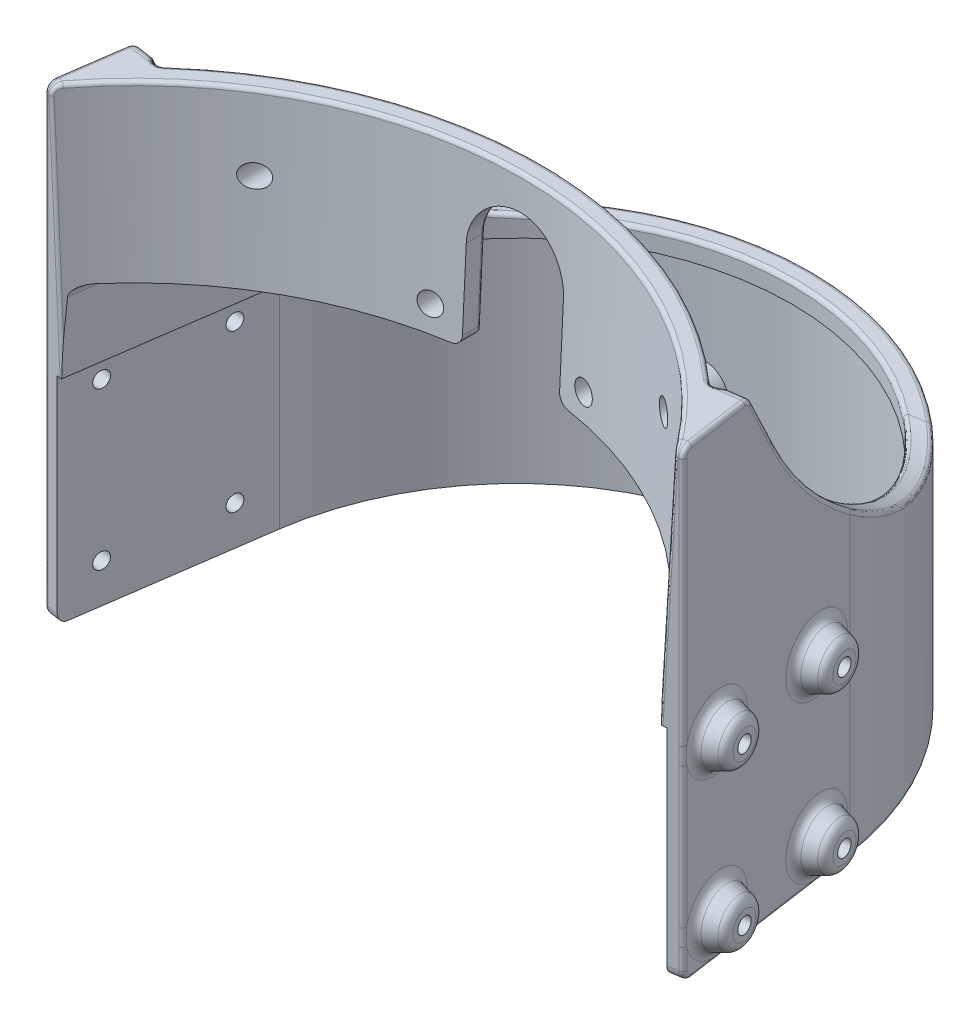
SolidWorks part; units mm, degrees
ref_plane "Front Plane" through (0, 0, 0) normal (0, 0, 1) x (1, 0, 0)
ref_plane "Top Plane" through (0, 0, 0) normal (0, 1, 0) x (1, 0, 0)
ref_plane "Right Plane" through (0, 0, 0) normal (1, 0, 0) x (0, 0, -1)
sketch "Sketch1" plane through (0, 0, 0) normal (0, 1, 0) x (1, 0, 0)
  line L0 (-94.2861, -143.8372) -> (-103.2971, -206.6946)
  line L1 (-103.2971, -206.6946) -> (-98.5828, -207.3704)
  line L2 (-98.5828, -207.3704) -> (-89.5718, -144.513)
  line L3 (0, -157.3537) -> (0, 60.4833) construction
  line L4 (103.2971, -206.6946) -> (98.5828, -207.3704)
  line L5 (98.5828, -207.3704) -> (89.5718, -144.513)
  line L6 (94.2861, -143.8372) -> (103.2971, -206.6946)
  line L8 (0, -157.3537) -> (-94.2861, -143.8372) construction
  line L9 (-89.5718, -144.513) -> (-107.0231, -266.2464) construction
  arc A0 (94.2861, -143.8372) -> (-94.2861, -143.8372) centre (0, -157.3537) ccw
  arc A1 (-89.5718, -144.513) -> (89.5718, -144.513) centre (0, -157.3537) cw
  arc A2 (89.5718, -144.513) -> (-89.5718, -144.513) centre (0, -157.3537) ccw construction
  dimension "D2" = 4.7625
  dimension "D3" = 63.5
extrude "Boss-Extrude1" add sketch "Sketch1" along normal blind 76.2
sketch "Sketch17" plane through (0, 76.2, 0) normal (0, 1, 0) x (1, 0, 0)
  line L10 (-97.0114, -207.5957) -> (-88.0003, -144.7383)
  line L11 (88.0003, -144.7383) -> (97.0114, -207.5957)
  line L12 (-98.5828, -207.3704) -> (-89.5718, -144.513)
  line L13 (89.5718, -144.513) -> (98.5828, -207.3704)
  line L14 (-98.5828, -207.3704) -> (-89.5718, -144.513)
  line L15 (89.5718, -144.513) -> (98.5828, -207.3704)
  line L16 (98.5828, -207.3704) -> (97.0114, -207.5957)
  line L17 (-97.0114, -207.5957) -> (-98.5828, -207.3704)
  arc A4 (88.0003, -144.7383) -> (-88.0003, -144.7383) centre (0, -157.3537) ccw
  arc A5 (89.5718, -144.513) -> (-89.5718, -144.513) centre (0, -157.3537) ccw
  arc A6 (89.5718, -144.513) -> (-89.5718, -144.513) centre (0, -157.3537) ccw
  dimension "D1" = 0
  dimension "D2" = 1.5875
extrude "Boss-Extrude5" add sketch "Sketch17" against normal blind 6.35
hole_wizard "1/4-20 Tapped Hole2" positions "Sketch14" profile "Sketch15" tap size "1/4-20" standard "ANSI Inch"
sketch "Sketch14" plane through (-72.1826, 0, -10.3479) normal (-0.9899, 0, -0.1419) x (-0.1419, 0, 0.9899)
  line L1 (168.4613, 63.5) -> (206.5613, 63.5) construction
  line L2 (168.4613, 63.5) -> (168.4613, 12.7) construction
  line L3 (168.4613, 12.7) -> (206.5613, 12.7) construction
  line L4 (206.5613, 63.5) -> (206.5613, 12.7) construction
  line L5 (168.4613, 63.5) -> (206.5613, 12.7) construction
  line L6 (168.4613, 12.7) -> (206.5613, 63.5) construction
  line L14 (155.7613, 0) -> (219.2613, 0) construction
  line L15 (219.2613, 76.2) -> (219.2613, 0) construction
  point P3 (206.5613, 12.7)
  point P110 (168.4613, 63.5)
  point P111 (168.4613, 12.7)
  point P112 (206.5613, 63.5)
  point P150 (187.5113, 38.1)
  dimension "D1" = 50.8
  dimension "D2" = 38.1
  dimension "D3" = 38.1
  dimension "D4" = 31.75
sketch "Sketch15" plane through (-101.4949, 12.7, 194.1231) normal (0, 1, 0) x (-0.1419, 0, 0.9899)
  line L0 (0, 0) -> (0, 13.6835)
  line L1 (0, 13.6835) -> (2.5527, 13.6835)
  line L2 (2.5527, 13.6835) -> (2.5527, 0)
  line L5 (2.5527, 0) -> (0, 0)
  line L11 (0, -6.35) -> (0, 107.95) construction
  dimension "Thread Major Dia." = 5.1054
  dimension "Thru Tap Drill Depth" = 13.6835
sketch "Sketch31" plane through (-72.1826, 0, -10.3479) normal (-0.9899, 0, -0.1419) x (-0.1419, 0, 0.9899)
  circle A0 centre (168.4613, 63.5) radius 9.525
  circle A1 centre (206.5613, 63.5) radius 9.525
  circle A2 centre (206.5613, 12.7) radius 9.525
  circle A3 centre (168.4613, 12.7) radius 9.525
  dimension "D1" = 19.05
extrude "Boss-Extrude6" add sketch "Sketch31" along normal blind 7.9375
hole_wizard "1/4-20 Tapped Hole3" positions "Sketch32" profile "Sketch33" tap size "1/4-20" standard "ANSI Inch"
sketch "Sketch32" plane through (-80.0398, 0, -11.4743) normal (-0.9899, 0, -0.1419) x (-0.1419, 0, 0.9899)
  point P0 (168.4613, 63.5)
  point P3 (206.5613, 63.5)
  point P6 (206.5613, 12.7)
  point P9 (168.4613, 12.7)
sketch "Sketch33" plane through (-103.9455, 63.5, 155.2823) normal (0, 1, 0) x (-0.1419, 0, 0.9899)
  line L0 (0, 0) -> (0, 206.1523)
  line L1 (0, 206.1523) -> (2.5527, 206.1523)
  line L2 (2.5527, 206.1523) -> (2.5527, 0)
  line L5 (2.5527, 0) -> (0, 0)
  line L11 (0, -6.35) -> (0, 107.95) construction
  dimension "Thread Major Dia." = 5.1054
  dimension "Thru Tap Drill Depth" = 206.1523
sketch "Sketch39" plane through (-72.1826, 0, -10.3479) normal (-0.9899, 0, -0.1419) x (-0.1419, 0, 0.9899)
  line L0 (219.2613, 76.2) -> (219.2613, 149.86)
  line L1 (219.2613, 149.86) -> (193.8613, 149.86)
  line L2 (193.8613, 149.86) -> (155.7613, 76.2)
  line L4 (155.7613, 76.2) -> (219.2613, 76.2)
  line L7 (219.2613, 76.2) -> (219.2613, 0) construction
  dimension "D1" = 73.66
  dimension "D2" = 25.4
extrude "Boss-Extrude7" add sketch "Sketch39" against normal blind 6.35
mirror "Mirror2" about plane through (0, 0, 0) normal (1, 0, 0) of "Boss-Extrude7", "1/4-20 Tapped Hole3", "Boss-Extrude6", "1/4-20 Tapped Hole2"
sketch "Sketch36" plane through (0, 0, 0) normal (1, 0, 0) x (0, 0, -1)
  line L0 (-155.6512, 149.86) -> (-158.3162, 95.25)
  line L1 (-158.3162, 95.25) -> (-155.2174, 158.75) construction
  line L2 (-158.3162, 95.25) -> (-151.9587, 95.25)
  line L3 (-151.9587, 95.25) -> (-149.2937, 149.86)
  line L4 (-280.9474, 99.06) -> (-280.9474, 197.9835) construction
  line L6 (-149.2937, 149.86) -> (-155.6512, 149.86)
  line L10 (-206.6946, 149.86) -> (-181.5516, 149.86) construction
  line L11 (-167.2168, 95.25) -> (-158.3162, 95.25) construction
  dimension "D2" = 6.35
revolve "Revolve1" add sketch "Sketch36" about L4
sketch "Sketch44" plane through (0, 0, 0) normal (1, 0, 0) x (0, 0, -1)
  line L0 (-155.6512, 149.86) -> (-162.9644, 0)
  line L1 (-162.9644, 0) -> (-180.9521, 0)
  line L3 (-180.9521, 0) -> (-180.9521, 149.86)
  line L4 (-180.9521, 149.86) -> (-155.6512, 149.86)
  line L5 (-280.9474, 250.5823) -> (-280.9474, 56.4129) construction
  line L12 (-158.3162, 95.25) -> (-130.6953, 95.25) construction
  line L15 (-207.3704, 0) -> (-144.513, 0) construction
  dimension "D1" = 25.3009
chamfer "Chamfer4" distance 7.9375 angle 20 4 edges at (-110.7037, 12.7, 202.4253) (-105.2971, 12.7, 164.7109) (-110.7037, 63.5, 202.4253) (-105.2971, 63.5, 164.7109)
chamfer "Chamfer5" distance 7.9375 angle 20 4 edges at (110.7037, 12.7, 202.4253) (110.7037, 63.5, 202.4253) (105.2971, 63.5, 164.7109) (105.2971, 12.7, 164.7109)
fillet "Fillet1" radius 101.6 2 edges at (91.1432, 76.2, 144.2877) (-91.1432, 76.2, 144.2877)
sketch "Sketch43" plane through (0, 0, 0) normal (0, 0, 1) x (1, 0, 0)
  line L4 (-15.7201, 95.25) -> (15.7201, 95.25)
  line L6 (-15.7183, 123.7631) -> (-15.7201, 96.0828)
  line L7 (15.7201, 96.0828) -> (15.7183, 123.7631)
  line L8 (-15.7183, 123.7631) -> (-15.7201, 95.25)
  line L9 (15.7201, 95.25) -> (15.7183, 123.7631)
  line L19 (-95.022, 95.25) -> (95.022, 95.25) construction
  spline S3 degree 3 poles (-4842.4899, -1040.5795) (-637.748, -163.601) (32.2701, 43.383) (15.3122, 127.3124) (15.1865, 127.8073) (14.8845, 128.7879) (14.7075, 129.2748) (14.1118, 130.6897) (13.6266, 131.5831) (12.7684, 132.8498) (12.4591, 133.2613) (11.8013, 134.0515) (11.4553, 134.4274) (10.3681, 135.4994) (9.5778, 136.1405) (8.2915, 136.9896) (7.8461, 137.253) (6.941, 137.7306) (6.4789, 137.9463) (5.5358, 138.3324) (5.0548, 138.5028) (4.0737, 138.7975) (3.5709, 138.9224) (2.0526, 139.2211) (1.0352, 139.3198) (-0.4988, 139.321) (-1.0114, 139.2968) (-2.0393, 139.1975) (-2.5517, 139.1226) (-4.0604, 138.8267) (-5.0382, 138.5347) (-6.4628, 137.9536) (-6.933, 137.7346) (-7.8414, 137.2558) (-8.2809, 136.9958) (-9.5568, 136.1557) (-10.3509, 135.5154) (-11.8198, 134.069) (-12.4712, 133.286) (-13.3283, 132.0246) (-13.5939, 131.5895) (-14.0837, 130.6892) (-14.3082, 130.2227) (-14.9043, 128.8082) (-15.2048, 127.8361) (-15.5106, 126.334) (-15.5883, 125.8247) (-27.0509, 12.3972) (1210.903, -180.63) (4930.8683, -566.4945) knots -5.158971 -5.158971 -5.158971 -5.158971 0.0625 0.0625 0.09375 0.09375 0.125 0.125 0.1875 0.1875 0.21875 0.21875 0.25 0.25 0.3125 0.3125 0.34375 0.34375 0.375 0.375 0.40625 0.40625 0.4375 0.4375 0.5 0.5 0.53125 0.53125 0.5625 0.5625 0.625 0.625 0.65625 0.65625 0.6875 0.6875 0.75 0.75 0.8125 0.8125 0.84375 0.84375 0.875 0.875 0.9375 0.9375 0.96875 0.96875 7.83165 7.83165 7.83165 7.83165 only from (15.7183, 123.7631) to (-15.7183, 123.7631)
  spline S4 degree 3 poles (15.7183, 123.7631) (15.7182, 124.7981) (15.6148, 125.8144) (15.3122, 127.3124) (15.1865, 127.8073) (14.8845, 128.7879) (14.7075, 129.2748) (14.1118, 130.6897) (13.6266, 131.5831) (12.7684, 132.8498) (12.4591, 133.2613) (11.8013, 134.0515) (11.4553, 134.4274) (10.3681, 135.4994) (9.5778, 136.1405) (8.2915, 136.9896) (7.8461, 137.253) (6.941, 137.7306) (6.4789, 137.9463) (5.5358, 138.3324) (5.0548, 138.5028) (4.0737, 138.7975) (3.5709, 138.9224) (2.0526, 139.2211) (1.0352, 139.3198) (-0.4988, 139.321) (-1.0114, 139.2968) (-2.0393, 139.1975) (-2.5517, 139.1226) (-4.0604, 138.8267) (-5.0382, 138.5347) (-6.4628, 137.9536) (-6.933, 137.7346) (-7.8414, 137.2558) (-8.2809, 136.9958) (-9.5568, 136.1557) (-10.3509, 135.5154) (-11.8198, 134.069) (-12.4712, 133.286) (-13.3283, 132.0246) (-13.5939, 131.5895) (-14.0837, 130.6892) (-14.3082, 130.2227) (-14.9043, 128.8082) (-15.2048, 127.8361) (-15.5106, 126.334) (-15.5883, 125.8247) (-15.6922, 124.7964) (-15.7182, 124.2806) (-15.7183, 123.7631) knots 0 0 0 0 0.0625 0.0625 0.09375 0.09375 0.125 0.125 0.1875 0.1875 0.21875 0.21875 0.25 0.25 0.3125 0.3125 0.34375 0.34375 0.375 0.375 0.40625 0.40625 0.4375 0.4375 0.5 0.5 0.53125 0.53125 0.5625 0.5625 0.625 0.625 0.65625 0.65625 0.6875 0.6875 0.75 0.75 0.8125 0.8125 0.84375 0.84375 0.875 0.875 0.9375 0.9375 0.96875 0.96875 1 1 1 1
  dimension "D1" = 0
extrude "Cut-Extrude5" cut sketch "Sketch43" along normal blind 190.5
revolve "Cut-Revolve2" cut sketch "Sketch44" angle 360 about L5
fillet "Fillet2" radius 3.175 4 edges at (95.8705, 95.25, 199.6372) (-95.8705, 95.25, 199.6372)
fillet "Fillet4" radius 0.635 6 edges at (54.7442, 95.25, 164.152) (89.2308, 95.25, 187.5492) (-54.7442, 95.25, 164.152) (-89.9013, 95.25, 187.7612) (92.4885, 94.8193, 187.1684) (-92.4885, 94.8193, 187.1684)
fillet "Fillet3" radius 3.175 8 edges at (-102.2234, 149.86, 206.8485) (102.2234, 149.86, 206.8485) (95.9795, 149.86, 182.0839) (-95.9795, 149.86, 182.0839) (-15.7201, 95.25, 156.4287) (15.7201, 95.25, 156.4287) (100.94, 0, 207.0325) (-100.94, 0, 207.0325)
fillet "Fillet6" radius 3.175 16 edges at (-104.8871, 63.5, 161.8511) (-94.7366, 63.5, 146.98) (-104.8871, 12.7, 161.8511) (-94.7366, 12.7, 146.98) (-110.2938, 12.7, 199.5655) (-100.1433, 12.7, 184.6945) (-110.2938, 63.5, 199.5655) (-100.1433, 63.5, 184.6945) (102.8466, 12.7, 203.5517) (108.4104, 12.7, 186.4279) (97.4399, 12.7, 165.8373) (103.0038, 12.7, 148.7134) (97.4399, 63.5, 165.8373) (103.0038, 63.5, 148.7134) (102.8466, 63.5, 203.5517) (108.4104, 63.5, 186.4279)
fillet "Fillet11" radius 1.27 5 edges at (17.5464, 95.5506, 153.2232) (-17.5464, 95.5506, 153.2232) (-1.701, 139.2292, 149.8235)
ref_plane "Plane1" through (0, 0, 152.4) normal (0, 0, 1) x (1, 0, 0)
sketch "Sketch50" plane through (0, 0, 152.4) normal (0, 0, 1) x (1, 0, 0)
  line L3 (17.1587, 96.6228) -> (17.1552, 123.7013) construction
  line L4 (88.3364, 95.854) -> (18.9882, 95.854) construction
  line L5 (0, 0) -> (0, 173.4532) construction
  line L6 (0, 69.85) -> (0, 0) construction
  circle A0 centre (24.7778, 103.474) radius 7.62
  circle A1 centre (-24.7778, 103.474) radius 7.62
  dimension "D1" = 15.24
extrude "Boss-Extrude10" add sketch "Sketch50" along normal up to next
ref_plane "Plane2" through (0, 0, 162.56) normal (0, 0, 1) x (1, 0, 0)
sketch "Sketch53" plane through (0, 0, 162.56) normal (0, 0, 1) x (1, 0, 0)
  line L0 (-59.7938, 126.334) -> (-72.4645, 126.334) construction
  line L3 (0, 0) -> (0, 186.1536) construction
  line L4 (-59.7938, 102.87) -> (-59.7938, 139.7) construction
  line L5 (-24.7778, 95.854) -> (-88.3364, 95.854) construction
  circle A0 centre (-66.1292, 126.334) radius 7.62
  circle A1 centre (66.1292, 126.334) radius 7.62
  dimension "D1" = 15.24
  dimension "D2" = 12.6707
  dimension "D3" = 30.48
extrude "Boss-Extrude11" add sketch "Sketch53" along normal up to next
hole_wizard "9/32 (0.28125) Diameter Hole2" positions "Sketch51" profile "Sketch52" hole size "9/32" standard "ANSI Inch"
sketch "Sketch51" plane through (0, 0, 152.4) normal (0, 0, -1) x (-1, 0, 0)
  circle A2 centre (-24.7778, 103.474) radius 7.62 construction
  circle A3 centre (24.7778, 103.474) radius 7.62 construction
  point P0 (-24.7778, 103.474)
  point P2 (24.7778, 103.474)
  point P27 (-66.1292, 126.334)
  point P30 (66.1292, 126.334)
sketch "Sketch52" plane through (24.7778, 103.474, 152.4) normal (1, 0, 0) x (0, 1, 0)
  line L0 (0, 0) -> (0, 55.1957)
  line L1 (0, 55.1957) -> (3.5719, 55.1957)
  line L2 (3.5719, 55.1957) -> (3.5719, 0)
  line L5 (3.5719, 0) -> (0, 0)
  line L11 (0, -6.35) -> (0, 107.95) construction
  dimension "Thru Hole Dia." = 7.1437
  dimension "Thru Hole Depth" = 55.1957
fillet "Fillet13" radius 1.27 8 edges at (29.3531, 109.5676, 154.6255) (29.3531, 109.5676, 154.6255) (-19.1954, 98.2873, 153.245) (-19.1954, 98.2873, 153.245) (-63.7653, 133.5781, 166.6753) (72.5373, 130.4571, 172.2155)
fillet "Fillet14" radius 1.27 37 edges at (-100.4416, 148.9776, 206.1154) (100.7019, 148.4765, 206.5073) (91.1536, 149.5878, 183.4285) (92.5675, 138.4227, 176.5967) (90.2814, 112.5873, 160.6503) (82.4678, 84.6964, 124.1533) (0, 76.2, 68.4537) (-90.842, 149.6159, 183.5392) (-92.5675, 138.4227, 176.5967) (-90.2814, 112.5873, 160.6503) (98.5663, 0, 173.6944) (103.1652, 0.9299, 205.774) (103.2971, 74.93, 206.6946) (103.1652, 148.9301, 205.774) (101.4067, 149.86, 193.508) (99.7327, 149.3972, 181.8304) (98.9421, 139.6331, 176.3154) (96.5672, 112.5873, 159.7492) (79.5963, 78.467, 105.0374) (0, 76.2, 62.1037) (-88.6523, 84.3774, 122.5209) (-96.5672, 112.5873, 159.7492) (-98.9421, 139.6331, 176.3154) (-99.7327, 149.3972, 181.8304) (-101.4067, 149.86, 193.508) (-103.1652, 148.9301, 205.774) (-103.2971, 74.93, 206.6946) (-103.1652, 0.9299, 205.774) (-98.5663, 0, 173.6944) (0, 149.86, 155.6512) (0, 149.86, 149.2937) (-71.6447, 78.1681, 104.7206) (0, 0, 62.1037)
